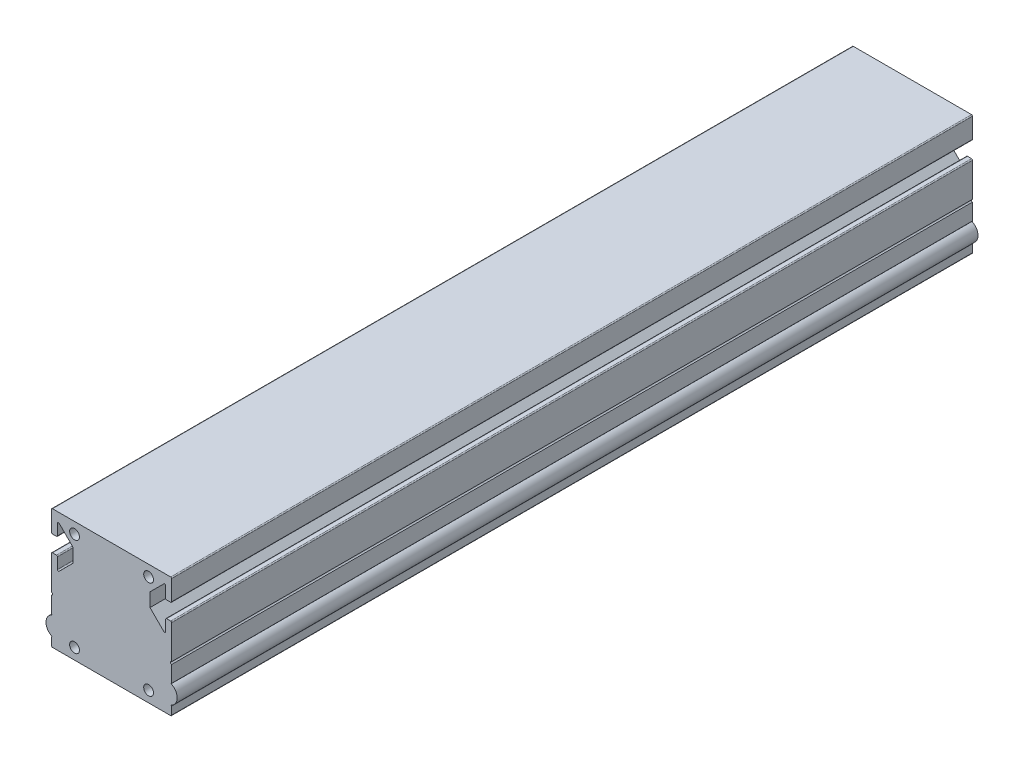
SolidWorks part; units mm, degrees
ref_plane "Ebene vorne" through (0, 0, 0) normal (0, 0, 1) x (1, 0, 0)
ref_plane "Ebene oben" through (0, 0, 0) normal (0, 1, 0) x (1, 0, 0)
ref_plane "Ebene rechts" through (0, 0, 0) normal (1, 0, 0) x (0, 0, -1)
sketch "Aussen" plane through (0, 0, 0) normal (0, 0, 1) x (1, 0, 0)
  line L4 (30, -30) -> (30, 30)
  line L5 (-30, 30) -> (-30, -30)
  line L6 (30, 30) -> (-30, 30)
  line L7 (30, -30) -> (-30, -30)
  point P3 (0, 30)
  point P4 (-30, 0)
  dimension "D1" = 60
  dimension "D2" = 60
extrude "Linear austragen1" add sketch "Aussen" along normal blind 400
sketch "Markierung" plane through (0, 0, 0) normal (0, 0, 1) x (1, 0, 0)
  line L0 (30, -30) -> (30, 30) construction
  line L1 (30, -7.6) -> (30, -6.4)
  line L2 (-30, -30) -> (30, -30) construction
  arc A1 (30, -6.4) -> (30, -7.6) centre (30, -7) ccw
  dimension "D1" = 0.6
  dimension "D2" = 23
extrude "Schnitt-Linear austragen2" cut sketch "Markierung" along normal through all
sketch "Führung" plane through (0, 0, 0) normal (0, 0, 1) x (1, 0, 0)
  line L0 (30, -30) -> (30, -7.6) construction
  line L1 (-30, -30) -> (30, -30) construction
  line L2 (30, -25.1958) -> (30, -16.2042)
  arc A1 (30, -16.2042) -> (30, -25.1958) centre (27.7, -20.7) ccw
  dimension "D1" = 5.05
  dimension "D2" = 2.3
  dimension "D3" = 9.3
extrude "Schnitt-Linear austragen3" cut sketch "Führung" along normal through all
sketch "NUT" plane through (0, 0, 0) normal (0, 0, 1) x (1, 0, 0)
  line L0 (30, -6.4) -> (30, 30) construction
  line L1 (30, 10.95) -> (30, 19.05)
  line L7 (30, 10.95) -> (27, 10.95)
  line L8 (27, 10.95) -> (27, 3.7929)
  line L9 (27, 3.7929) -> (19.2, 11.5929)
  line L10 (19.2, 11.5929) -> (19.2, 18.4071)
  line L11 (19.2, 18.4071) -> (27, 26.2071)
  line L12 (27, 26.2071) -> (27, 19.05)
  line L13 (27, 19.05) -> (30, 19.05)
  dimension "D1" = 19.2
  dimension "D2" = 7.8
  dimension "D3" = 26.2071
  dimension "D4" = 3.7929
  dimension "D5" = 7.1571
extrude "Schnitt-Linear austragen4" cut sketch "NUT" along normal through all
mirror "Spiegeln2" about plane through (0, 0, 0) normal (1, 0, 0) of "Schnitt-Linear austragen4", "Schnitt-Linear austragen3", "Schnitt-Linear austragen2"
fillet "Verrundung1" radius 0.5 16 edges at (30, 19.05, 200) (30, 10.95, 200) (27, 3.7929, 200) (27, 10.95, 200) (27, 26.2071, 200) (27, 19.05, 200) (30, -30, 200) (30, 30, 200) (-30, -30, 200) (-27, 3.7929, 200) (-27, 10.95, 200) (-30, 10.95, 200) (-30, 30, 200) (-30, 19.05, 200) (-27, 19.05, 200) (-27, 26.2071, 200)
fillet "Verrundung2" radius 0.3 4 edges at (30, -16.2042, 200) (30, -25.1958, 200) (-30, -25.1958, 200) (-30, -16.2042, 200)
hole_wizard "Ø4.9 (4.9) Durchmesser Bohrung1" positions "Skizze7" profile "Skizze8" hole size "Ø4.9" standard "DIN"
sketch "Skizze7" plane through (0, 0, 0) normal (0, 0, -1) x (-1, 0, 0)
  line L1 (-29.5, 30) -> (29.5, 30) construction
  line L2 (30, 29.5) -> (30, 19.55) construction
  line L3 (-30, 19.55) -> (-30, 29.5) construction
  line L4 (-30, -29.5) -> (-30, -25.6621) construction
  point P0 (-18.5, 24.5)
  point P5 (18.5, 24.5)
  point P8 (-18.5, -24.5)
  point P11 (18.5, -24.5)
  dimension "D1" = 37
  dimension "D2" = 49
  dimension "D3" = 37
  dimension "D4" = 49
  dimension "D5" = 5.5
  dimension "D6" = 11.5
  dimension "D7" = 11.5
  dimension "D8" = 11.5
sketch "Skizze8" plane through (18.5, 24.5, 0) normal (1, 0, 0) x (0, 1, 0)
  line L0 (0, 0) -> (0, 400)
  line L1 (0, 400) -> (2.45, 400)
  line L2 (2.45, 400) -> (2.45, 0)
  line L5 (2.45, 0) -> (0, 0)
  line L11 (0, -6.35) -> (0, 107.95) construction
  dimension "Bohrerdurchmesser" = 4.9
  dimension "Bohrungstiefe" = 400
sketch "Skizze9" plane through (0, 0, 400) normal (0, 0, 1) x (1, 0, 0)
  circle A0 centre (-27.7, -20.7) radius 5.05
  circle A1 centre (27.7, -20.7) radius 5.05
  dimension "D1" = 10.1
  dimension "D2" = 10.1
extrude "Linear austragen2" add sketch "Skizze9" against normal up to surface (400 mm away)
